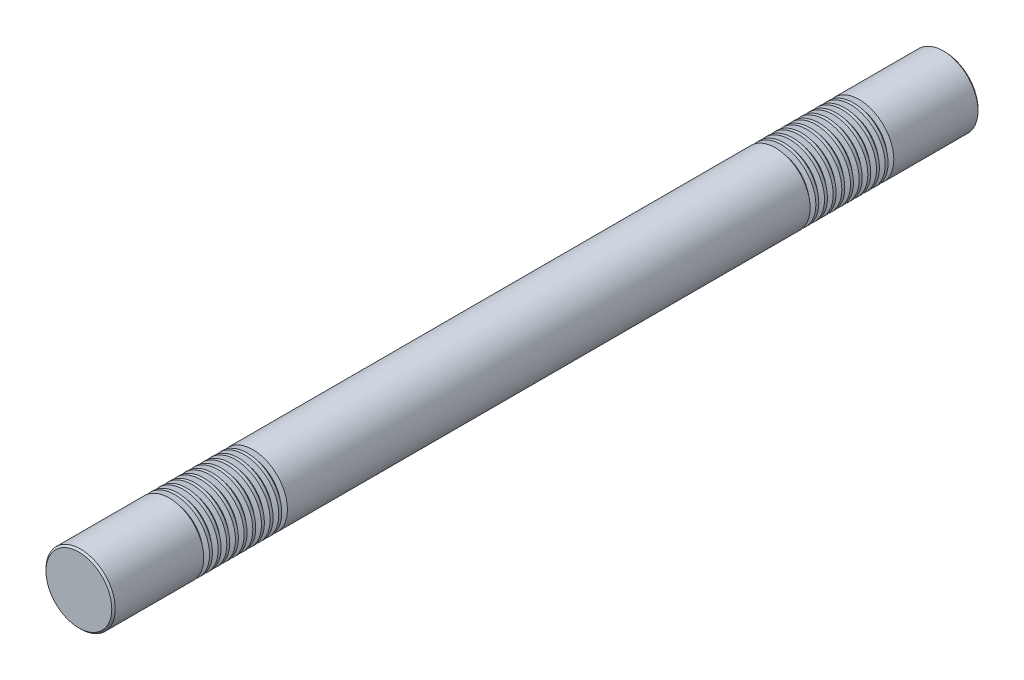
SolidWorks part; units mm, degrees
ref_plane "Front Plane" through (0, 0, 0) normal (0, 0, 1) x (1, 0, 0)
ref_plane "Top Plane" through (0, 0, 0) normal (0, 1, 0) x (1, 0, 0)
ref_plane "Right Plane" through (0, 0, 0) normal (1, 0, 0) x (0, 0, -1)
sketch "Sketch1" plane through (0, 0, 0) normal (0, 0, 1) x (1, 0, 0)
  circle A0 centre (0, 0) radius 40
  dimension "D1" = 80
extrude "Boss-Extrude1" add sketch "Sketch1" along normal mid plane 1000
chamfer "Chamfer1" distance 2 angle 45 2 edges at (40, 0, -500) (40, 0, 500)
sketch "Sketch2" plane through (0, 0, 0) normal (1, 0, 0) x (0, 0, -1)
  line L0 (400.8038, 40) -> (394.1962, 40)
  line L1 (498, 40) -> (-498, 40) construction
  line L2 (394.1962, 40) -> (395.8038, 34)
  line L3 (395.8038, 34) -> (399.1962, 34)
  line L4 (399.1962, 34) -> (400.8038, 40)
  line L5 (500, -38) -> (500, 38) construction
  point P4 (397.5, 40)
  point P7 (397.5, 34)
  point P8 (400, 37)
  point P9 (395, 37)
  dimension "D1" = 5
  dimension "D2" = 100
  dimension "D3" = 6
  dimension "D4" = 30
revolve "Cut-Revolve1" cut sketch "Sketch2" angle 360 about axis through (0, 0, 500) along (0, 0, -1)
pattern_linear "LPattern1" count 10 spacing 10 along (0, 0, 1) of "Cut-Revolve1"
pattern_linear "LPattern2" count 2 spacing 700 along (0, 0, 1) of "Cut-Revolve1", "LPattern1"
